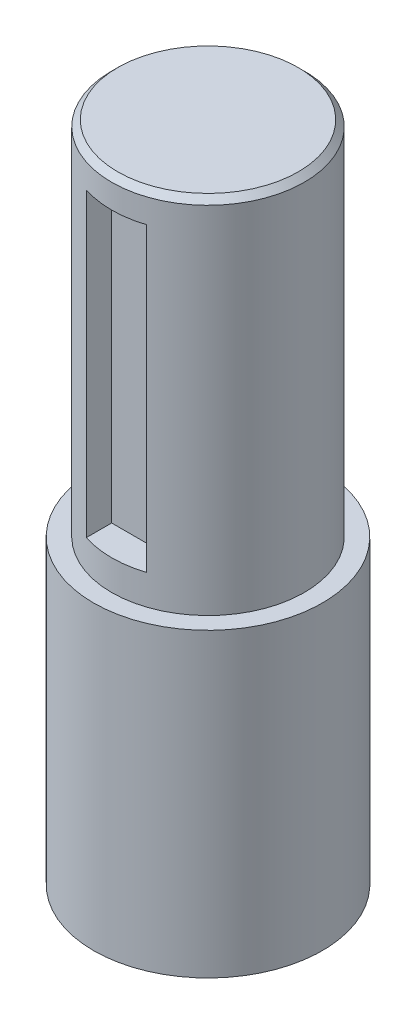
SolidWorks part; units mm, degrees
ref_plane "Front Plane" through (0, 0, 0) normal (0, 0, 1) x (1, 0, 0)
ref_plane "Top Plane" through (0, 0, 0) normal (0, 1, 0) x (1, 0, 0)
ref_plane "Right Plane" through (0, 0, 0) normal (1, 0, 0) x (0, 0, -1)
sketch "Sketch1" plane through (0, 0, 0) normal (0, 1, 0) x (1, 0, 0)
  circle A0 centre (0, 0) radius 16
  dimension "D1" = 32
extrude "Boss-Extrude1" add sketch "Sketch1" along normal blind 60
sketch "Sketch2" plane through (0, 0, 0) normal (0, 0, 1) x (1, 0, 0)
  line L0 (0, 0) -> (0, 60) construction
  line L1 (16, 60) -> (-16, 60) construction
  line L3 (-5, 55) -> (5, 55)
  line L4 (-5, 55) -> (-5, 5)
  line L5 (-5, 5) -> (5, 5)
  line L6 (5, 55) -> (5, 5)
  line L7 (-5, 55) -> (5, 5) construction
  line L8 (-5, 5) -> (5, 55) construction
  point P5 (0, 30)
  dimension "D1" = 50
  dimension "D2" = 10
  dimension "D3" = 5
extrude "Cut-Extrude1" cut sketch "Sketch2" against normal blind 5 from offset 16
sketch "Sketch3" plane through (0, 0, 0) normal (0, -1, 0) x (1, 0, 0)
  circle A0 centre (0, 0) radius 19
  dimension "D1" = 38
extrude "Boss-Extrude2" add sketch "Sketch3" along normal blind 50
chamfer "Chamfer1" distance 1 angle 45 1 edges at (0, 60, 16)
